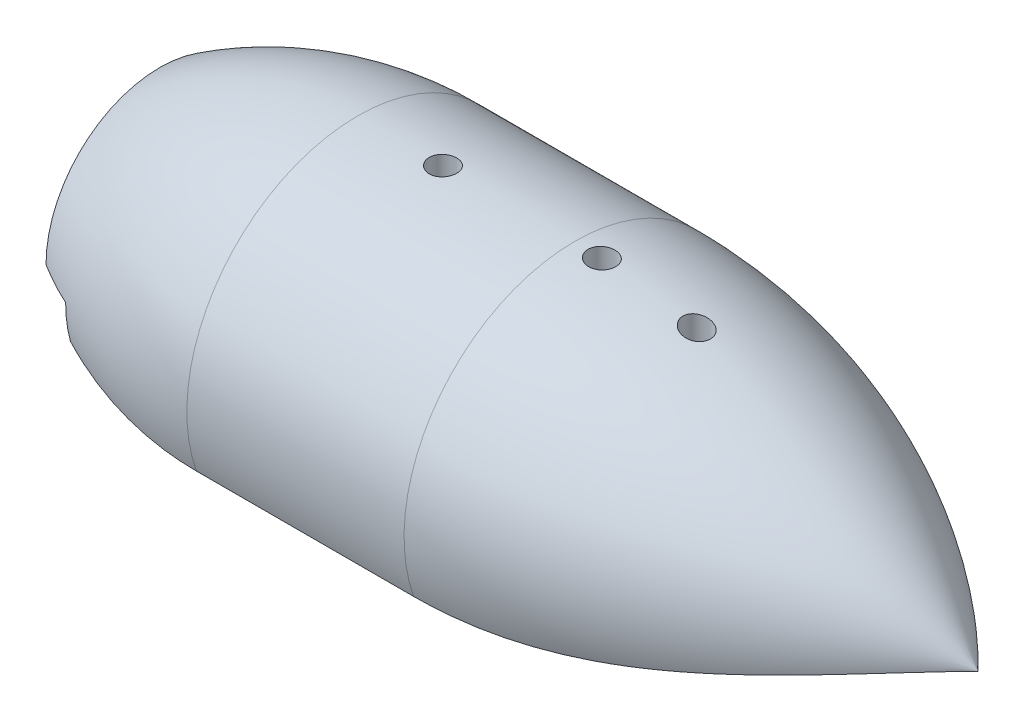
SolidWorks part; units mm, degrees
ref_plane "Front Plane" through (0, 0, 0) normal (0, 0, 1) x (1, 0, 0)
ref_plane "Top Plane" through (0, 0, 0) normal (0, 1, 0) x (1, 0, 0)
ref_plane "Right Plane" through (0, 0, 0) normal (1, 0, 0) x (0, 0, -1)
sketch "Sketch2" plane through (0, 0, 0) normal (1, 0, 0) x (0, 0, -1)
  circle A0 centre (0, 0) radius 18.288
  dimension "D1" = 36.576
extrude "Extrude1" add sketch "Sketch2" along normal blind 87.63
sketch "Sketch3" plane through (0, 0, 0) normal (0, 0, 1) x (1, 0, 0)
  line L0 (87.63, -18.288) -> (87.63, 18.288) construction
  line L2 (44.45, 0) -> (44.45, 18.288) construction
  line L3 (87.63, 18.288) -> (0, 18.288) construction
  line L4 (87.63, 0.0088) -> (87.63, 18.288)
  line L5 (87.63, 18.288) -> (44.45, 18.288)
  line L6 (0, 0) -> (21.1849, 0) construction
  line L7 (21.1849, 0) -> (21.1849, 18.288) construction
  line L8 (0, 0) -> (0, 12.192) construction
  line L9 (0, 18.288) -> (0, -18.288) construction
  line L10 (21.1849, 18.288) -> (0, 18.288)
  line L11 (0, 18.288) -> (0, 12.192)
  arc A0 (44.45, 18.288) -> (87.63, 0.0088) centre (44.45, -41.8525) cw
  arc A1 (21.1849, 18.288) -> (0, 12.192) centre (21.1849, -21.5709) ccw
  dimension "D1" = 12.192
revolve "shape" cut sketch "Sketch3" angle 360 about L6
sketch "Sketch5" plane through (0, 0, 0) normal (-1, 0, 0) x (0, 0, 1)
  circle A0 centre (0, 0) radius 7.9375
  dimension "D1" = 15.875
extrude "Cut-Extrude2" cut sketch "Sketch5" against normal blind 24.13
sketch "Sketch4" plane through (0, 0, 0) normal (-1, 0, 0) x (0, 0, 1)
  line L0 (0, -20.6375) -> (0, 0) construction
  line L1 (16.3949, -8.103) -> (-16.3949, -8.103)
  line L2 (0, -20.6375) -> (16.3949, -8.103) construction
  line L3 (16.3949, -8.103) -> (16.3949, -20.6375)
  line L4 (16.3949, -20.6375) -> (-16.3949, -20.6375)
  line L5 (-16.3949, -20.6375) -> (-16.3949, -8.103)
  circle A1 centre (0, 0) radius 18.288 construction
  dimension "D1" = 20.6375
  dimension "D2" = 20.6375
extrude "Cut-Extrude1" cut sketch "Sketch4" against normal through all
sketch "Sketch8" plane through (0, 0, 0) normal (0, 1, 0) x (1, 0, 0)
  line L0 (26.2128, 3.2946) -> (26.2128, 11.8036)
  line L1 (26.2128, 3.2946) -> (34.4678, 3.2946)
  line L2 (18.923, 11.8036) -> (26.2128, 11.8036)
  line L3 (26.2128, -3.3094) -> (34.4678, -3.3094)
  line L4 (18.923, 11.8036) -> (18.923, -11.8184)
  line L5 (18.923, -11.8184) -> (26.2128, -11.8184)
  line L6 (26.2128, -11.8184) -> (26.2128, -3.3094)
  line L7 (34.4678, 11.8036) -> (42.3418, 11.8036)
  line L8 (34.4678, -11.8184) -> (34.4678, -3.3094)
  line L9 (34.4678, -11.8184) -> (42.3418, -11.8184)
  line L10 (42.3418, 11.8036) -> (42.3418, -11.8184)
  line L11 (34.4678, 3.2946) -> (34.4678, 11.8036)
  line L12 (42.3418, -0.0074) -> (18.923, -0.0074) construction
  line L13 (0, 0) -> (92.1788, -0.0362) construction
  line L14 (0, 12.192) -> (0, -12.192) construction
  line L15 (26.2128, 3.2946) -> (26.2128, -3.3094) construction
  point P20 (26.2128, -0.0074)
  dimension "D1" = 7.2898
  dimension "D2" = 7.874
  dimension "D3" = 8.255
  dimension "D4" = 18.923
  dimension "D5" = 23.622
  dimension "D6" = 6.604
extrude "camera base and transmitter" cut sketch "Sketch8" along normal blind 12.954 and the other way through all
fillet "Fillet1" radius 1.5875 8 edges at (42.3418, 2.4255, -11.8036) (34.4678, 2.4255, -11.8036) (26.2128, 2.4255, -11.8036) (18.923, 2.4255, -11.8036) (42.3418, 2.4255, 11.8184) (34.4678, 2.4255, 11.8184) (26.2128, 2.4255, 11.8184) (18.923, 2.4255, 11.8184)
sketch "r" plane through (0, 0, 0) normal (0, 1, 0) x (1, 0, 0)
  line L1 (65.7098, -0.0074) -> (42.3418, -0.0074) construction
  line L2 (42.3418, 3.1676) -> (42.3418, -3.1824)
  line L3 (42.3418, -3.1824) -> (65.7098, -3.1824)
  line L4 (65.7098, 3.1676) -> (65.7098, -3.1824)
  line L5 (42.3418, 3.1676) -> (65.7098, 3.1676)
  line L6 (42.3418, -10.2309) -> (42.3418, 10.2161) construction
  line L7 (42.3418, -10.2309) -> (42.3418, 10.2161) construction
  dimension "D1" = 6.35
  dimension "D2" = 23.368
extrude "tab slot" cut sketch "r" along normal blind 10.16 and the other way through all
sketch "Sketch9" plane through (18.923, 0, 0) normal (1, 0, 0) x (0, 0, -1)
  line L1 (-7.874, 7.874) -> (7.874, 7.874)
  line L2 (-7.874, 7.874) -> (-7.874, -2.6762)
  line L3 (-7.874, -2.6762) -> (7.874, -2.6762)
  line L4 (7.874, 7.874) -> (7.874, -2.6762)
extrude "Cut-Extrude6" cut sketch "Sketch9" against normal blind 5.588
sketch "Sketch10" plane through (0, 0, 0) normal (0, 1, 0) x (1, 0, 0)
  line L0 (0, 12.192) -> (0, -12.192) construction
  line L1 (0, -12.7042) -> (10.9133, -12.7042)
  line L2 (0, -12.7042) -> (0, 12.8228)
  line L3 (0, 12.8228) -> (10.9133, 12.8228)
  line L4 (10.9133, -12.7042) -> (10.9133, -7.874)
  line L5 (15.1084, 0.0593) -> (0, 0.0593) construction
  line L6 (18.923, 10.2161) -> (18.923, -10.2309) construction
  line L7 (10.9133, -7.874) -> (18.923, -7.874)
  line L8 (18.923, -7.874) -> (18.923, 7.874)
  line L9 (18.923, 7.874) -> (10.9133, 7.874)
  line L11 (10.9133, 7.874) -> (10.9133, 12.8228)
  line L12 (10.9133, -7.874) -> (10.9133, 7.874) construction
  dimension "D1" = 25.527
extrude "holder interface" cut sketch "Sketch10" against normal through all
sketch "Sketch11" plane through (0, 0, 0) normal (0, 0, 1) x (1, 0, 0)
  line L0 (0, 12.192) -> (0, 0) construction
  line L1 (0, -7.3177) -> (4.572, -7.3177)
  line L2 (0, -7.3177) -> (0, 0)
  line L3 (0, 0) -> (4.572, 0)
  line L4 (4.572, -7.3177) -> (4.572, 0)
  line L5 (0.8391, 0) -> (10.9133, 0) construction
  point P6 (0.8391, 0)
  point P7 (5.491, -8.103)
  dimension "D1" = 4.572
extrude "Cut-Extrude8" cut sketch "Sketch11" against normal through all and the other way through all
fillet "Fillet2" radius 3.175 2 edges at (13.335, 4.438, 7.874) (13.335, 4.438, -7.874)
fillet "Fillet3" radius 3.175 2 edges at (65.7098, 1.0285, 3.1824) (65.7098, 1.0285, -3.1676)
sketch "Sketch13" plane through (0, 12.954, 0) normal (0, -1, 0) x (1, 0, 0)
  line L3 (26.2128, 3.3094) -> (26.2128, -3.2946) construction
  line L4 (34.4678, 3.3094) -> (34.4678, -3.2946) construction
  line L5 (34.4678, 0.0074) -> (26.2128, 0.0074) construction
sketch "Sketch14" plane through (0, 10.16, 0) normal (0, -1, 0) x (1, 0, 0)
  line L0 (65.7098, 0.0074) -> (34.4678, 0.0074) construction
  line L1 (34.4678, -10.2161) -> (34.4678, -3.2946) construction
  line L2 (34.4678, 3.3094) -> (34.4678, -3.2946) construction
hole_wizard "#4 Clearance Hole1" positions "3DSketch1" profile "Sketch12" hole size "#4" standard "Ansi Inch"
sketch3d "3DSketch1"
  line L1 (65.7098, 10.16, 0.0074) -> (34.4678, 10.16, 0.0074) construction
  line L2 (34.4678, 12.954, 0.0074) -> (26.2128, 12.954, 0.0074) construction
  point P0 (30.3403, 12.954, 0.0074)
  point P2 (47.3583, 10.16, 0.0074)
  point P4 (57.5183, 10.16, 0.0074)
  dimension "D1" = 10.16
  dimension "D2" = 12.8905
sketch "Sketch12" plane through (30.3403, 12.954, 0.0074) normal (1, 0, 0) x (0, 0, -1)
  line L0 (0, 0) -> (0, 5.334)
  line L1 (0, 5.334) -> (1.4732, 5.334)
  line L2 (1.4732, 5.334) -> (1.4732, 0)
  line L5 (1.4732, 0) -> (0, 0)
  line L11 (0, -6.35) -> (0, 107.95) construction
  dimension "Thru Hole Dia." = 2.9464
  dimension "Thru Hole Depth" = 5.334
fillet "Fillet4" radius 2.54 2 edges at (10.9133, -4.0515, -12.8228) (10.9133, -4.0515, 12.7042)
sketch "Sketch15" plane through (0, -8.103, 0) normal (0, -1, 0) x (1, 0, 0)
  circle A0 centre (38.792, 0.0074) radius 4.7625
  dimension "D1" = 9.525
extrude "Cut-Extrude9" cut sketch "Sketch15" against normal offset from surface (22.835 mm away) 1.778
sketch "Sketch16" plane through (0, 0, 0) normal (-1, 0, 0) x (0, 0, 1)
  circle A0 centre (0, -27.7812) radius 27.7813
  dimension "D1" = 55.5625
extrude "Cut-Extrude10" cut sketch "Sketch16" against normal through all
